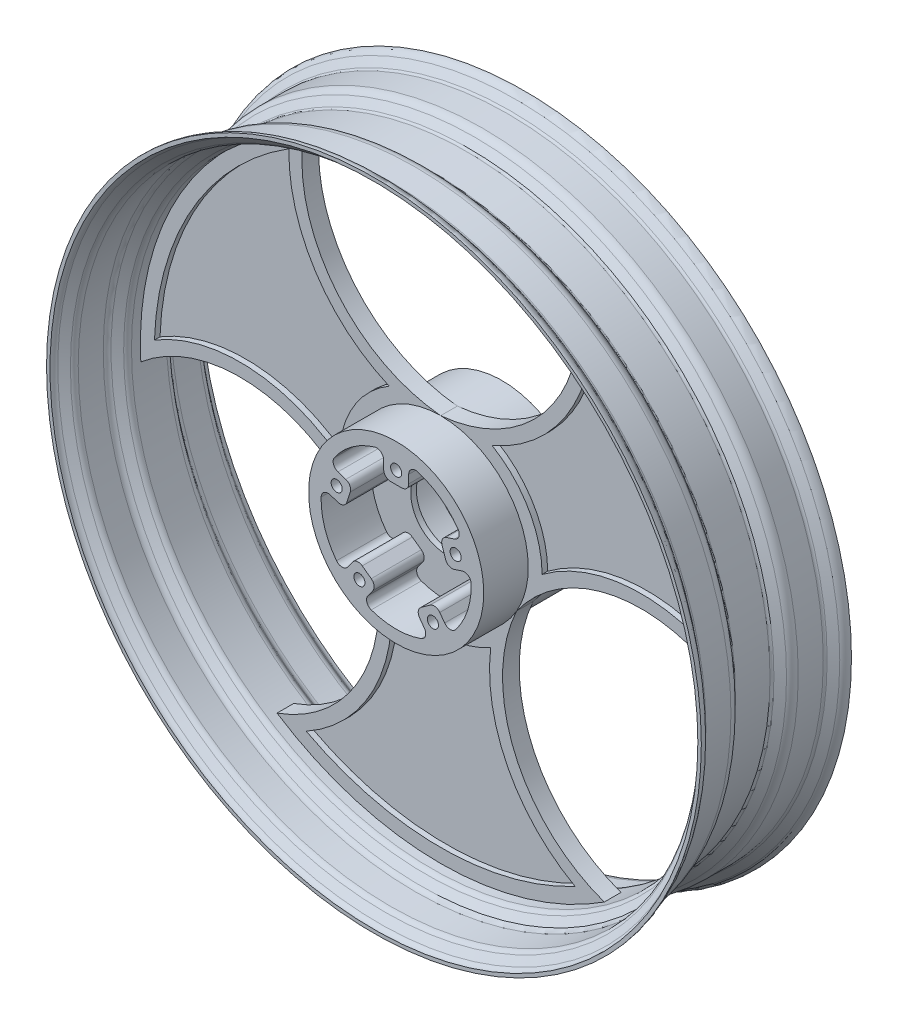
SolidWorks part; units mm, degrees
ref_plane "Front Plane" through (0, 0, 0) normal (0, 0, 1) x (1, 0, 0)
ref_plane "Top Plane" through (0, 0, 0) normal (0, 1, 0) x (1, 0, 0)
ref_plane "Right Plane" through (0, 0, 0) normal (1, 0, 0) x (0, 0, -1)
sketch "Sketch1" plane through (0, 0, 0) normal (1, 0, 0) x (0, 0, -1)
  line L0 (0, 106.096) -> (0, -87.6732) construction
  line L1 (-108.1057, 0) -> (149.1229, 0) construction
  line L27 (-38, 0) -> (38, 0)
  line L28 (38, 0) -> (38, 63)
  line L29 (-38, 0) -> (-38, 63)
  line L30 (38, 63) -> (6, 63)
  line L31 (-38, 63) -> (-6, 63)
  line L32 (6, 63) -> (6, 216)
  line L33 (-6, 63) -> (-6, 216)
  line L34 (6, 216) -> (12.4092, 216)
  line L35 (-6, 216) -> (-12.4092, 216)
  line L36 (16.2394, 217.7861) -> (20.3744, 222.7139)
  line L37 (-16.2394, 217.7861) -> (-20.3744, 222.7139)
  line L38 (24.2046, 224.5) -> (42.2046, 224.5)
  line L39 (-24.2046, 224.5) -> (-42.2046, 224.5)
  line L40 (46.0348, 226.2861) -> (50.1698, 231.2139)
  line L41 (-46.0348, 226.2861) -> (-50.1698, 231.2139)
  line L42 (54, 233) -> (54, 235.5)
  line L43 (-54, 233) -> (-54, 235.5)
  line L44 (48.2547, 232.8209) -> (44.1197, 227.893)
  line L45 (-48.2547, 232.8209) -> (-44.1197, 227.893)
  line L46 (42.2046, 227) -> (24.2046, 227)
  line L47 (-42.2046, 227) -> (-24.2046, 227)
  line L48 (18.4592, 224.3209) -> (14.3243, 219.393)
  line L49 (-18.4592, 224.3209) -> (-14.3243, 219.393)
  line L50 (12.4092, 218.5) -> (0, 218.5)
  line L51 (-12.4092, 218.5) -> (0, 218.5)
  arc A16 (12.4092, 216) -> (16.2394, 217.7861) centre (12.4092, 221) ccw
  arc A17 (-12.4092, 216) -> (-16.2394, 217.7861) centre (-12.4092, 221) cw
  arc A18 (20.3744, 222.7139) -> (24.2046, 224.5) centre (24.2046, 219.5) cw
  arc A19 (-20.3744, 222.7139) -> (-24.2046, 224.5) centre (-24.2046, 219.5) ccw
  arc A20 (42.2046, 224.5) -> (46.0348, 226.2861) centre (42.2046, 229.5) ccw
  arc A21 (-42.2046, 224.5) -> (-46.0348, 226.2861) centre (-42.2046, 229.5) cw
  arc A22 (50.1698, 231.2139) -> (54, 233) centre (54, 228) cw
  arc A23 (-50.1698, 231.2139) -> (-54, 233) centre (-54, 228) ccw
  arc A24 (54, 235.5) -> (48.2547, 232.8209) centre (54, 228) ccw
  arc A25 (-54, 235.5) -> (-48.2547, 232.8209) centre (-54, 228) cw
  arc A26 (44.1197, 227.893) -> (42.2046, 227) centre (42.2046, 229.5) cw
  arc A27 (-44.1197, 227.893) -> (-42.2046, 227) centre (-42.2046, 229.5) ccw
  arc A28 (24.2046, 227) -> (18.4592, 224.3209) centre (24.2046, 219.5) ccw
  arc A29 (-24.2046, 227) -> (-18.4592, 224.3209) centre (-24.2046, 219.5) cw
  arc A30 (14.3243, 219.393) -> (12.4092, 218.5) centre (12.4092, 221) cw
  arc A31 (-14.3243, 219.393) -> (-12.4092, 218.5) centre (-12.4092, 221) ccw
  point P8 (0, 0)
  dimension "D2" = 76
  dimension "D11" = 5
  dimension "D1" = 2.5
  dimension "D3" = 32
  dimension "D4" = 63
  dimension "D5" = 432
  dimension "D6" = 50
  dimension "D7" = 54
  dimension "D8" = 18
  dimension "D9" = 8.5
  dimension "D10" = 8.5
revolve "Revolve1" add sketch "Sketch1" angle 360 about L1
sketch "Sketch2" plane through (0, 0, 6) normal (0, 0, 1) x (1, 0, 0)
  line L0 (0, 278.9193) -> (0, -275.6484) construction
  arc A0 (0, 63) -> (98, 192.489) centre (-10.1738, 172.5285) ccw
  circle A2 centre (0, 0) radius 63 construction
  circle A3 centre (0, 0) radius 216 construction
  arc A4 (0, 63) -> (-98, 192.489) centre (10.1738, 172.5285) cw
  arc A5 (-98, 192.489) -> (98, 192.489) centre (0, 0) cw
  dimension "D1" = 110
  dimension "D2" = 196
extrude "Cut-Extrude1" cut sketch "Sketch2" against normal up to next
pattern_circular "CirPattern1" count 3 over 360 about axis through (0, 0, 0) along (0, 0, 1) of "Cut-Extrude1"
sketch "Sketch3" plane through (0, 0, 6) normal (0, 0, 1) x (1, 0, 0)
  line L0 (-178.4012, 103) -> (0, 0) construction
  line L1 (0, 0) -> (0, 162.2188) construction
  arc A0 (-205.8745, 7.1893) -> (-109.1634, 174.6979) centre (0, 0) cw
  arc A1 (-109.1634, 174.6979) -> (-37.0383, 62.906) centre (10.1738, 172.5285) ccw
  arc A2 (-205.8745, 7.1893) -> (-72.9973, 0.6231) centre (-144.3271, -95.0751) cw
  arc A3 (-72.9973, 0.6231) -> (-37.0383, 62.906) centre (0, 0) cw
  circle A4 centre (0, 0) radius 63 construction
  arc A8 (-54.5596, -31.5) -> (-215.7003, -11.374) centre (-144.3271, -95.0751) ccw construction
  arc A9 (-98, 192.489) -> (0, 63) centre (10.1738, 172.5285) ccw construction
  dimension "D3" = 206
  dimension "D2" = 73
  dimension "D1" = 56
  dimension "D4" = 60
extrude "Cut-Extrude2" cut sketch "Sketch3" against normal blind 4
pattern_circular "CirPattern2" count 3 over 360 about axis through (0, 0, 0) along (0, 0, 1) of "Cut-Extrude2"
mirror "Mirror1" about plane through (0, 0, 0) normal (0, 0, 1) of "Cut-Extrude2", "CirPattern2"
sketch "Sketch4" plane through (0, 0, 38) normal (0, 0, 1) x (1, 0, 0)
  circle A0 centre (0, 0) radius 54
  dimension "D1" = 108
extrude "Cut-Extrude3" cut sketch "Sketch4" against normal up to surface (40 mm away)
mirror "Mirror4" about plane through (0, 0, 0) normal (0, 0, 1) of "Cut-Extrude3"
sketch "Sketch5" plane through (0, 0, 2) normal (0, 0, 1) x (1, 0, 0)
  circle A0 centre (0, 0) radius 25.5
  dimension "D1" = 51
extrude "Cut-Extrude4" cut sketch "Sketch5" against normal blind 241
sketch "Sketch6" plane through (0, 0, 38) normal (0, 0, 1) x (1, 0, 0)
  line L0 (0, 54) -> (0, 0) construction
  line L1 (-9, 36) -> (9, 36)
  line L2 (-9, 36) -> (-9, 53.2447)
  line L3 (9, 36) -> (9, 53.2447)
  arc A0 (9, 53.2447) -> (-9, 53.2447) centre (0, 0) ccw
  circle A1 centre (0, 0) radius 54 construction
  point P9 (0, 36)
  dimension "D1" = 36
  dimension "D2" = 18
extrude "Boss-Extrude1" add sketch "Sketch6" against normal up to next
sketch "Sketch7" plane through (0, 0, 38) normal (0, 0, 1) x (1, 0, 0)
  circle A0 centre (0, 45) radius 4
  circle A1 centre (0, 0) radius 45 construction
  dimension "D2" = 8
  dimension "D1" = 90
extrude "Cut-Extrude5" cut sketch "Sketch7" against normal blind 25
pattern_circular "CirPattern4" count 5 over 360 about axis through (0, 0, 0) along (0, 0, 1) of "Cut-Extrude5", "Boss-Extrude1"
fillet "Fillet1" radius 5 20 edges at (-53.4199, 7.894, 20) (24.0153, -48.3659, 20) (9, 53.2447, 20) (-38.5776, -37.7858, 20) (38.5776, -37.7858, 20) (28.4414, -23.8345, 20) (47.8576, 25.013, 20) (53.4199, 7.894, 20) (13.8791, -34.4147, 20) (31.4569, 19.6841, 20) (37.0192, 2.5651, 20) (9, 36, 20) (-9, 53.2447, 20) (-9, 36, 20) (-24.0153, -48.3659, 20) (-13.8791, -34.4147, 20) (-28.4414, -23.8345, 20) (-37.0192, 2.5651, 20) (-47.8576, 25.013, 20) (-31.4569, 19.6841, 20)
